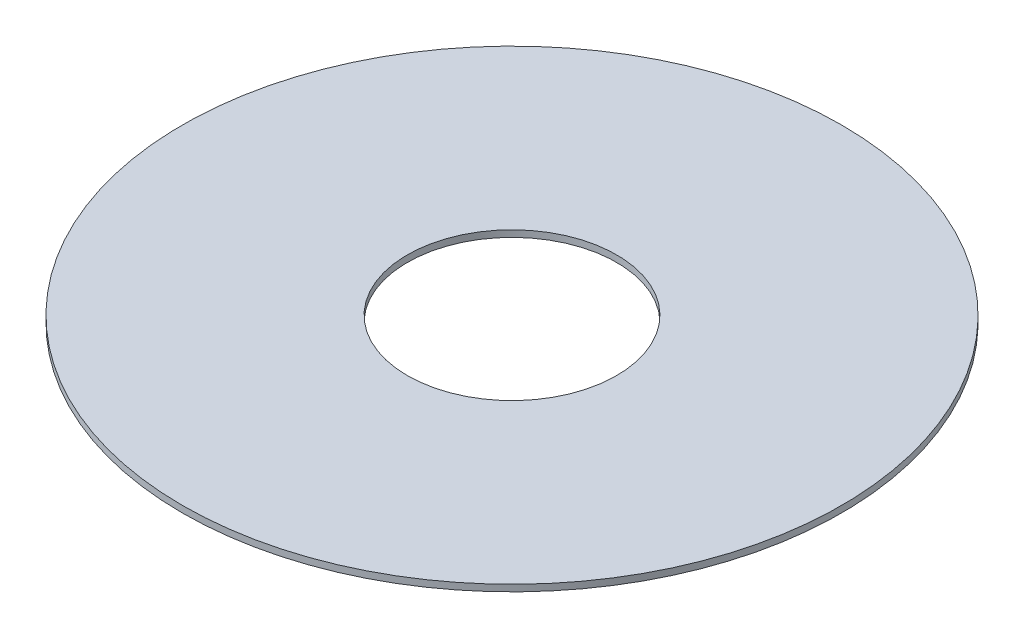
SolidWorks part; units mm, degrees
ref_plane "Ön Düzlem" through (0, 0, 0) normal (0, 0, 1) x (1, 0, 0)
ref_plane "Üst Düzlem" through (0, 0, 0) normal (0, 1, 0) x (1, 0, 0)
ref_plane "Sağ Düzlem" through (0, 0, 0) normal (1, 0, 0) x (0, 0, -1)
sketch "Çizim1" plane through (0, 0, 0) normal (0, 1, 0) x (1, 0, 0)
  circle A0 centre (0, 0) radius 31.75
  circle A1 centre (0, 0) radius 100
  dimension "D1" = 200
  dimension "D2" = 63.5
extrude "Yükseklik-Ekstrüzyon1" add sketch "Çizim1" along normal blind 2
